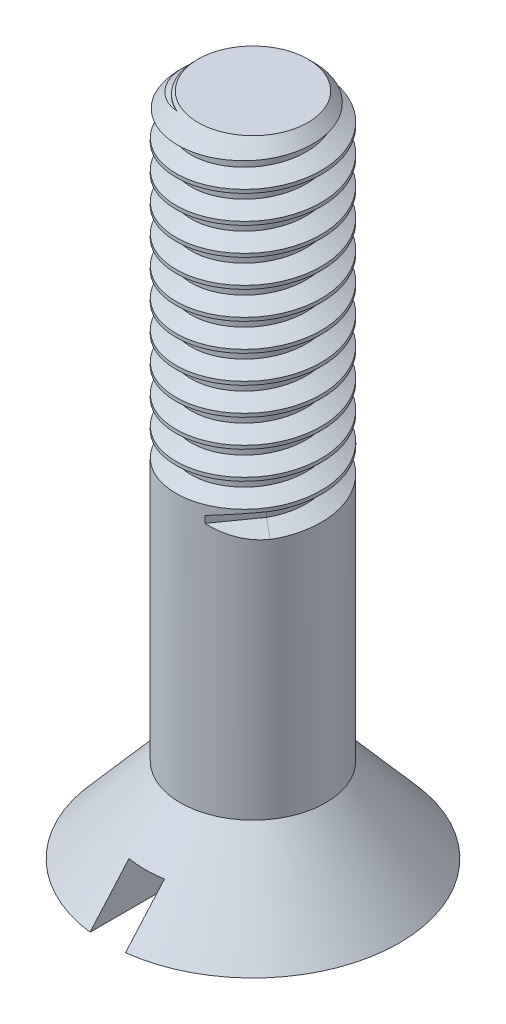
SolidWorks part; units mm, degrees
ref_plane "Front Plane" through (0, 0, 0) normal (0, 0, 1) x (1, 0, 0)
ref_plane "Top Plane" through (0, 0, 0) normal (0, 1, 0) x (1, 0, 0)
ref_plane "Right Plane" through (0, 0, 0) normal (1, 0, 0) x (0, 0, -1)
sketch "Sketch1" plane through (0, 0, 0) normal (0, 0, 1) x (1, 0, 0)
  line L0 (0, 0) -> (0, 19.05)
  line L1 (0, 19.05) -> (-1.5748, 19.05)
  line L2 (-2.0828, 18.542) -> (-2.0828, 2.4252)
  line L3 (-2.0828, 2.4252) -> (-4.191, 0)
  line L4 (-4.191, 0) -> (0, 0)
  line L5 (0, 0) -> (0, 27.4996) construction
  line L6 (-1.5748, 19.05) -> (-2.0828, 18.542)
  point P4 (-2.0828, 19.05)
  dimension "D1" = 19.05
  dimension "D2" = 4.1656
  dimension "D3" = 8.382
  dimension "D4" = 41
revolve "Revolve1" add sketch "Sketch1" angle 360 about L5
thread "Thread1" pitch 0.7937 start angle 0, offset 1.524, length 10, pitch 0.7937, diameter 4.1656
ref_plane "Plane1" through (-2.0828, 20.066, 0) normal (0, 0, 1) x (-1, 0, 0)
sketch "Thread Profile1" plane through (-2.0828, 20.066, 0) normal (0, 0, 1) x (-1, 0, 0)
  line L0 (0, 0) -> (0, 0.7937) construction
  line L11 (0, 0) -> (0, 0.6945)
  line L12 (0, 0.6945) -> (-0.4296, 0.4465)
  line L13 (-0.4296, 0.4465) -> (-0.4296, 0.248)
  line L15 (-0.4296, 0.248) -> (0, 0)
  line L17 (-0.4296, 0.3473) -> (0, 0.3473) construction
  point P2 (0, 0)
  dimension "Pitch" = 0.7937
  dimension "Profile_Angle" = 60
  dimension "Profile_Land" = 0.1984
  dimension "Profile_Height" = 0.4296
sketch "Sketch4" plane through (0, 0, 0) normal (0, 0, 1) x (1, 0, 0)
  line L1 (-0.508, -1.27) -> (0.508, -1.27)
  line L2 (-0.508, -1.27) -> (-0.508, 1.27)
  line L3 (-0.508, 1.27) -> (0.508, 1.27)
  line L4 (0.508, -1.27) -> (0.508, 1.27)
  line L5 (-0.508, -1.27) -> (0.508, 1.27) construction
  line L6 (-0.508, 1.27) -> (0.508, -1.27) construction
  point P0 (0, 0)
  dimension "D1" = 1.016
  dimension "D2" = 2.54
extrude "Cut-Extrude1" cut sketch "Sketch4" against normal through all both and the other way through all
sketch "Sketch5" plane through (-0.0001, 0, 0.0001) normal (0.5797, 0, -0.8148) x (-0.8148, 0, -0.5797)
  line L4 (-1.6532, 9.8174) -> (-2.0829, 10.0655)
  line L5 (-2.0829, 10.0655) -> (-2.0829, 9.371)
  line L6 (-2.0829, 9.371) -> (-1.6532, 9.619)
  line L7 (-1.6532, 9.619) -> (-1.6532, 9.8174)
  line L8 (-1.6532, 9.8174) -> (-2.0829, 10.0655)
  line L9 (-2.0829, 10.0655) -> (-2.0829, 9.371)
  line L10 (-2.0829, 9.371) -> (-1.6532, 9.619)
  line L11 (-1.6532, 9.619) -> (-1.6532, 9.8174)
  dimension "D1" = 0
extrude "Cut-Extrude2" cut sketch "Sketch5" against normal up to surface (0 mm away)
